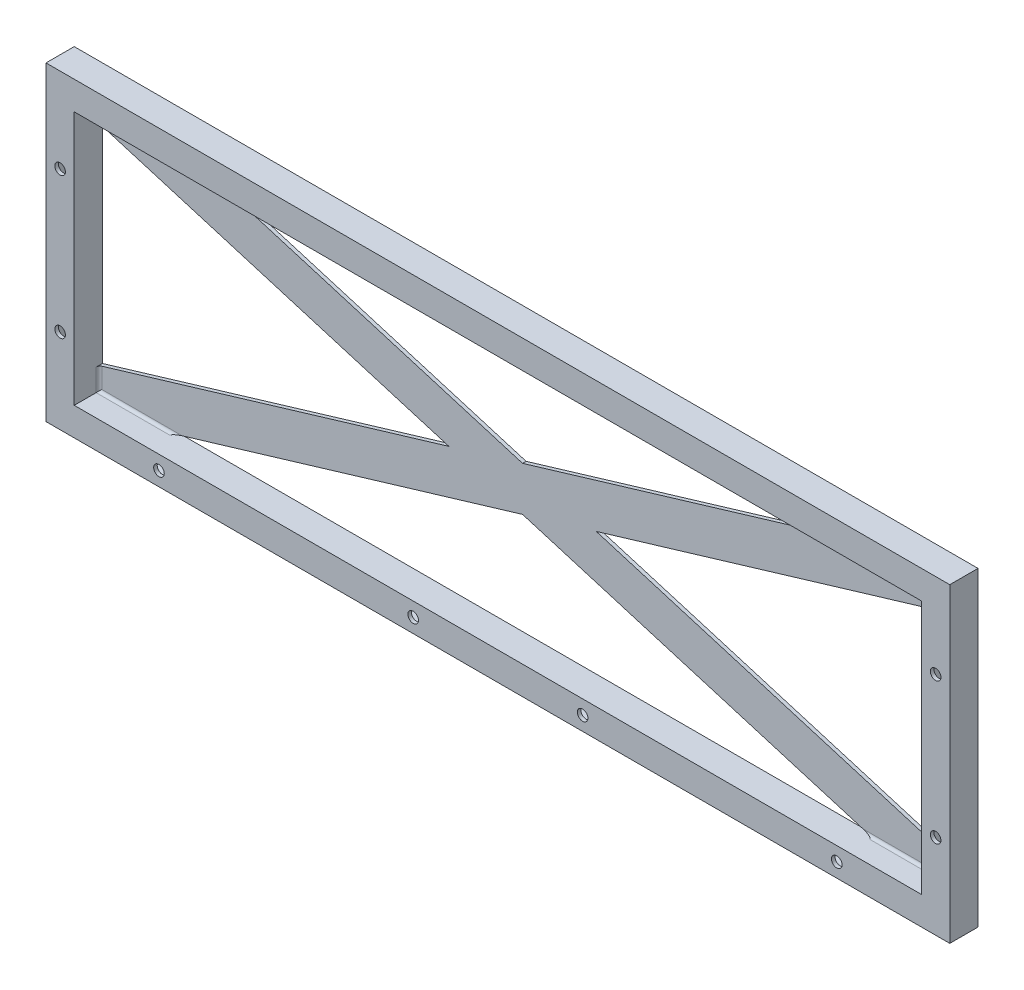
SolidWorks part; units mm, degrees
other "Outer tube"
ref_plane "Front Plane" through (0, 0, 0) normal (0, 0, 1) x (1, 0, 0)
ref_plane "Top Plane" through (0, 0, 0) normal (0, 1, 0) x (1, 0, 0)
ref_plane "Right Plane" through (0, 0, 0) normal (1, 0, 0) x (0, 0, -1)
sketch "Sketch1" plane through (0, 0, 0) normal (0, 0, 1) x (1, 0, 0)
  line L1 (381, -114.3) -> (-381, -114.3)
  line L2 (381, -114.3) -> (381, 114.3)
  line L3 (381, 114.3) -> (-381, 114.3)
  line L4 (-381, -114.3) -> (-381, 114.3)
  line L5 (381, -114.3) -> (-381, 114.3) construction
  line L6 (381, 114.3) -> (-381, -114.3) construction
  line L7 (406.4, -139.7) -> (-406.4, -139.7)
  line L8 (406.4, -139.7) -> (406.4, 139.7)
  line L9 (406.4, 139.7) -> (-406.4, 139.7)
  line L10 (-406.4, -139.7) -> (-406.4, 139.7)
  line L11 (406.4, -139.7) -> (-406.4, 139.7) construction
  line L12 (406.4, 139.7) -> (-406.4, -139.7) construction
  point P0 (0, 0)
  point P6 (0, 0)
  dimension "30" = 762
  dimension "D2" = 812.8
  dimension "9" = 228.6
  dimension "11" = 279.4
extrude "Boss-Extrude1" add sketch "Sketch1" along normal blind 25.4
sketch "Sketch2" plane through (0, 0, 0) normal (0, 0, 1) x (1, 0, 0)
  line L0 (-381, 94.4112) -> (314.7041, -114.3)
  line L1 (-381, -114.3) -> (-381, 114.3) construction
  line L2 (381, -114.3) -> (-381, -114.3) construction
  line L3 (-314.7041, 114.3) -> (381, -94.4112)
  line L4 (381, 114.3) -> (-381, 114.3) construction
  line L5 (381, -114.3) -> (381, 114.3) construction
  line L6 (-381, -94.4112) -> (314.7041, 114.3)
  line L7 (-314.7041, -114.3) -> (381, 94.4112)
  line L8 (-381, -94.4112) -> (-381, -114.3)
  line L9 (381, 114.3) -> (-381, -114.3) construction
  line L10 (381, -114.3) -> (-381, 114.3) construction
  line L11 (-381, -114.3) -> (-314.7041, -114.3)
  line L12 (-381, 114.3) -> (-314.7041, 114.3)
  line L13 (-381, 114.3) -> (-381, 94.4112)
  line L14 (314.7041, 114.3) -> (381, 114.3)
  line L15 (381, 114.3) -> (381, 94.4112)
  line L16 (381, -94.4112) -> (381, -114.3)
  line L17 (381, -114.3) -> (314.7041, -114.3)
  dimension "D1" = 19.05
  dimension "D2" = 19.05
  dimension ".75" = 19.05
  dimension "D3" = 19.05
extrude "Boss-Extrude2" add sketch "Sketch2" along normal blind 3.175 separate body contours L8 L11 L7 L0 L6 | L12 L13 L0 L6 L3 | L15 L14 L6 L3 L7 | L17 L16 L3 L7 L0 | L0 L7 L3 L6
shell "Shell for outer tube" thickness 3.175
hole_wizard "3/8 (0.375) Diameter Hole2 (for side panels)" positions "Sketch12" profile "Sketch11" hole size "3/8" standard "ANSI Inch"
sketch "Sketch12" plane through (0, 0, 25.4) normal (0, 0, 1) x (1, 0, 0)
  line L0 (406.4, 139.7) -> (-406.4, 139.7) construction
  line L1 (-406.4, -139.7) -> (406.4, -139.7) construction
  line L2 (-406.4, 139.7) -> (-406.4, -139.7) construction
  point P0 (-393.7, -63.5)
  point P2 (-393.7, 63.5)
  dimension "D1" = 76.2
  dimension "D2" = 76.2
  dimension "D3" = 12.7
sketch "Sketch11" plane through (-393.7, -63.5, 25.4) normal (1, 0, 0) x (0, -1, 0)
  line L0 (0, 0) -> (0, 25.4)
  line L1 (0, 25.4) -> (4.7625, 25.4)
  line L2 (4.7625, 25.4) -> (4.7625, 0)
  line L5 (4.7625, 0) -> (0, 0)
  line L11 (0, -6.35) -> (0, 107.95) construction
  dimension "Thru Hole Dia." = 9.525
  dimension "Thru Hole Depth" = 25.4
mirror "mirror for side holes" about plane through (0, 0, 0) normal (1, 0, 0) of "3/8 (0.375) Diameter Hole2 (for side panels)"
other "Intersect1"
fillet "Fillet1" radius 2.54 8 edges
hole_wizard "3/8 (0.375) Diameter Hole1" positions "Sketch14" profile "Sketch13" hole size "3/8" standard "ANSI Inch"
sketch "Sketch14" plane through (0, 0, 25.4) normal (0, 0, 1) x (1, 0, 0)
  line L0 (-406.4, 139.7) -> (-406.4, -139.7) construction
  line L1 (0, -13.97) -> (0, 13.97) construction
  line L2 (-381, -114.3) -> (381, -114.3) construction
  point P0 (-304.8, -127)
  point P2 (-76.2, -127)
  dimension "D1" = 101.6
  dimension "D2" = 76.2
  dimension "D3" = 12.7
sketch "Sketch13" plane through (-304.8, -127, 25.4) normal (1, 0, 0) x (0, -1, 0)
  line L0 (0, 0) -> (0, 25.4001)
  line L1 (0, 25.4001) -> (4.7625, 25.4001)
  line L2 (4.7625, 25.4001) -> (4.7625, 0)
  line L5 (4.7625, 0) -> (0, 0)
  line L11 (0, -6.35) -> (0, 107.95) construction
  dimension "Thru Hole Dia." = 9.525
  dimension "Thru Hole Depth" = 25.4001
mirror "Mirror1" about plane through (0, 0, 0) normal (1, 0, 0) of "3/8 (0.375) Diameter Hole1"
